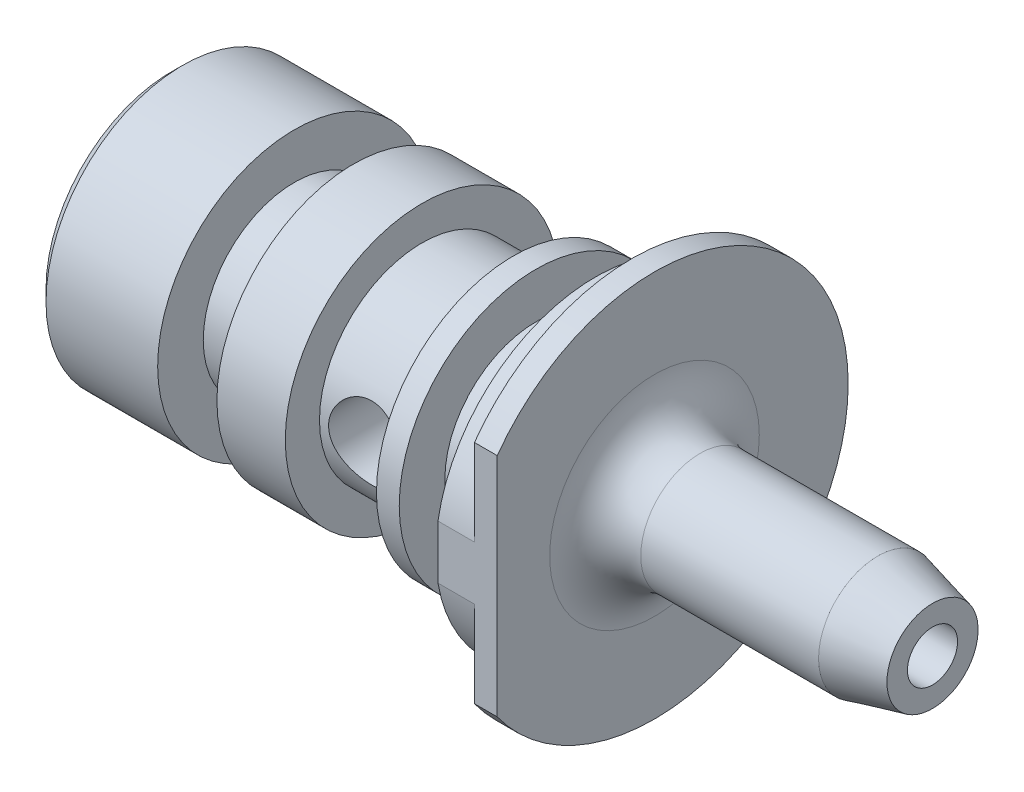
SolidWorks part; units mm, degrees
ref_plane "Face" through (0, 0, 0) normal (0, 0, 1) x (1, 0, 0)
ref_plane "Dessus" through (0, 0, 0) normal (0, 1, 0) x (1, 0, 0)
ref_plane "Droite" through (0, 0, 0) normal (1, 0, 0) x (0, 0, -1)
ref_plane "Plan4" through (0, 0, 0) normal (0, 0, -1) x (-1, 0, 0)
sketch "Esquisse1" plane through (0, 0, 0) normal (0, 0, -1) x (-1, 0, 0)
  line L0 (11.7, 0.55) -> (12.6526, 0)
  line L1 (12.6526, 0) -> (16.7, 0)
  line L2 (16.7, 0) -> (16.7, 2.75)
  line L3 (16.7, 2.75) -> (16.45, 3)
  line L4 (16.45, 3) -> (14, 3)
  line L5 (14, 3) -> (14, 2)
  line L6 (14, 2) -> (12.7, 2)
  line L7 (12.7, 2) -> (12.7, 3)
  line L8 (12.7, 3) -> (11.2, 3)
  line L9 (11.2, 3) -> (11.2, 2.25)
  line L10 (11.2, 2.25) -> (9.2, 2.25)
  line L11 (9.2, 2.25) -> (9.2, 3)
  line L12 (9.2, 3) -> (8.7, 3)
  line L13 (8.7, 3) -> (8.7, 2)
  line L14 (8.7, 2) -> (7.4, 2)
  line L15 (7.4, 2) -> (7.4, 3.5)
  line L16 (7.4, 3.5) -> (6.6, 3.5)
  line L17 (6.6, 3.5) -> (6.6, 4.25)
  line L18 (6.6, 4.25) -> (6.1, 4.25)
  line L19 (6.1, 4.25) -> (6.1, 1.3)
  line L20 (6.1, 1.3) -> (1.2, 1.3)
  line L21 (1.2, 1.3) -> (0, 1)
  line L22 (0, 1) -> (0, 0.55)
  line L23 (0, 0.55) -> (11.7, 0.55)
  line L24 (-0.0013, 0) -> (16.7013, 0) construction
revolve "Base-Révolution" add sketch "Esquisse1" angle 360 about L24
sketch "Esquisse2" plane through (0, 0, 0) normal (0, 0, 1) x (1, 0, 0)
  line L0 (-11.2, -3) -> (-11.2, 3) construction
  circle A0 centre (-10.2, 0) radius 0.8
  dimension "D1" = 1.6
  dimension "D2" = 1
extrude "Enlèv. mat.-Extru.1" cut sketch "Esquisse2" against normal through all and the other way through all
sketch "Esquisse3" plane through (-6.1, 0, 0) normal (1, 0, 0) x (0, 0, -1)
  line L1 (-5.3912, 3.0763) -> (-3.45, 3.0763)
  line L2 (-5.3912, 3.0763) -> (-5.3912, -3.0763)
  line L3 (-5.3912, -3.0763) -> (-3.45, -3.0763)
  line L4 (-3.45, 3.0763) -> (-3.45, -3.0763)
  dimension "D1" = 3.45
extrude "Enlèv. mat.-Extru.2" cut sketch "Esquisse3" against normal through all
fillet "Congé1" radius 1
